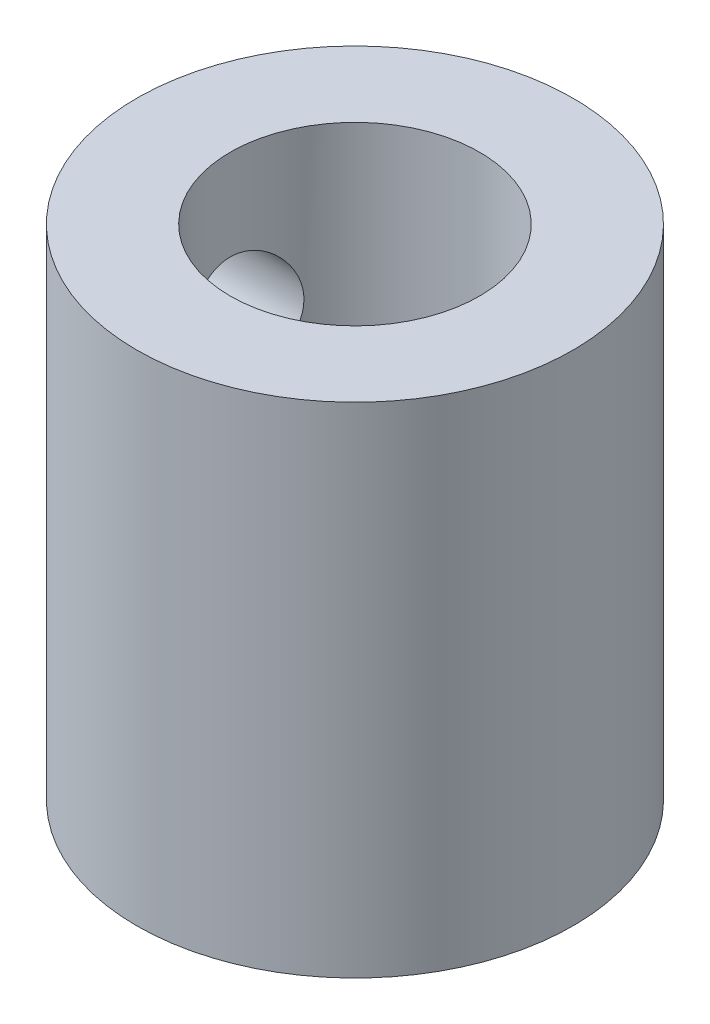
SolidWorks part; units mm, degrees
ref_plane "Front Plane" through (0, 0, 0) normal (0, 0, 1) x (1, 0, 0)
ref_plane "Top Plane" through (0, 0, 0) normal (0, 1, 0) x (1, 0, 0)
ref_plane "Right Plane" through (0, 0, 0) normal (1, 0, 0) x (0, 0, -1)
sketch "Sketch1" plane through (0, 0, 0) normal (0, 1, 0) x (1, 0, 0)
  circle A0 centre (0, 0) radius 5.5562
  circle A1 centre (0, 0) radius 1.5875
  dimension "D1" = 11.1125
  dimension "D2" = 3.175
extrude "Boss-Extrude1" add sketch "Sketch1" along normal blind 12.7
sketch "Sketch2" plane through (0, 12.7, 0) normal (0, 1, 0) x (1, 0, 0)
  circle A0 centre (0, 0) radius 3.175
  dimension "D1" = 6.35
extrude "Cut-Extrude1" cut sketch "Sketch2" against normal blind 8.255
sketch "Sketch4" plane through (0, 0, 0) normal (0, -1, 0) x (1, 0, 0)
  circle A0 centre (0, 0) radius 2.8575
  dimension "D1" = 5.715
extrude "Cut-Extrude3" cut sketch "Sketch4" against normal blind 3.556
sketch "Sketch3" plane through (0, 0, 0) normal (1, 0, 0) x (0, 0, -1)
  line L0 (5.5562, 12.7) -> (-5.5562, 12.7) construction
  circle A0 centre (0, 8.89) radius 1.5
  point P2 (0, 12.7)
  dimension "D1" = 3
  dimension "D2" = 3.81
extrude "Cut-Extrude2" cut sketch "Sketch3" against normal through all
